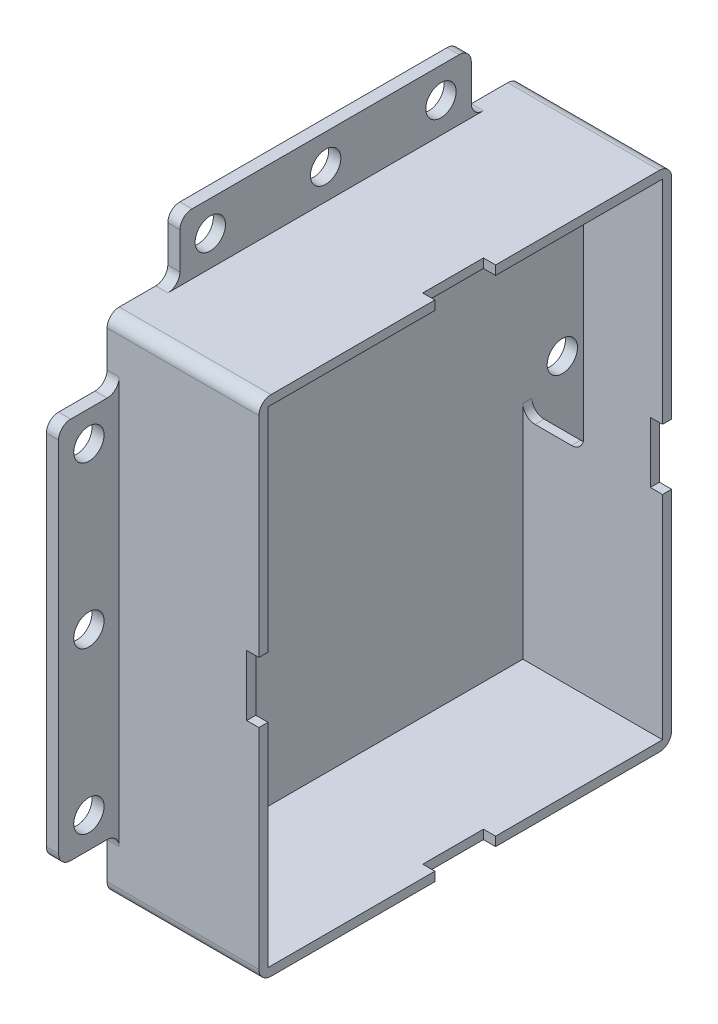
SolidWorks part; units mm, degrees
ref_plane "Plan de face" through (0, 0, 0) normal (1, 0, 0) x (0, 1, 0)
ref_plane "Plan de dessus" through (0, 0, 0) normal (0, 0, 1) x (0, 1, 0)
ref_plane "Plan de droite" through (0, 0, 0) normal (0, 1, 0) x (-1, 0, 0)
sketch "Esquisse1" plane through (0, 0, 0) normal (1, 0, 0) x (0, 1, 0)
  line L0 (-1.5, -1.5) -> (-1.5, 66.5)
  line L1 (0, 0) -> (80, 0)
  line L2 (0, 0) -> (0, 65)
  line L3 (0, 65) -> (80, 65)
  line L4 (80, 0) -> (80, 65)
  line L5 (-1.5, 66.5) -> (81.5, 66.5)
  line L6 (81.5, -1.5) -> (81.5, 66.5)
  line L7 (-1.5, -1.5) -> (81.5, -1.5)
  dimension "D1" = 65
  dimension "D2" = 80
  dimension "D3" = 1.5
extrude "Boss.-Extru.1" add sketch "Esquisse1" along normal blind 25
sketch "Esquisse2" plane through (0, 0, 0) normal (-1, 0, 0) x (0, -1, 0)
  line L1 (-81.5, 66.5) -> (1.5, 66.5)
  line L2 (-81.5, 66.5) -> (-81.5, -1.5)
  line L3 (-81.5, -1.5) -> (1.5, -1.5)
  line L4 (1.5, 66.5) -> (1.5, -1.5)
  line L5 (-71.5, -1.5) -> (-8.5, -1.5)
  line L6 (-71.5, -1.5) -> (-71.5, -11.5)
  line L7 (-71.5, -11.5) -> (-8.5, -11.5)
  line L8 (-8.5, -1.5) -> (-8.5, -11.5)
  line L9 (-81.5, 56.5) -> (-91.5, 56.5)
  line L10 (-81.5, 56.5) -> (-81.5, 8.5)
  line L11 (-81.5, 8.5) -> (-91.5, 8.5)
  line L12 (-91.5, 56.5) -> (-91.5, 8.5)
  line L13 (1.5, 56.5) -> (11.5, 56.5)
  line L14 (1.5, 56.5) -> (1.5, 8.5)
  line L15 (1.5, 8.5) -> (11.5, 8.5)
  line L16 (11.5, 56.5) -> (11.5, 8.5)
  line L17 (-71.5, 66.5) -> (-8.5, 66.5)
  line L18 (-71.5, 66.5) -> (-71.5, 76.5)
  line L19 (-71.5, 76.5) -> (-8.5, 76.5)
  line L20 (-8.5, 66.5) -> (-8.5, 76.5)
  circle A0 centre (-86.5, 51.5) radius 2.5
  circle A1 centre (-86.5, 32.5) radius 2.5
  circle A2 centre (-86.5, 13.5) radius 2.5
  circle A3 centre (-66.5, -6.5) radius 2.5
  circle A4 centre (-40, -6.5) radius 2.5
  circle A5 centre (-13.5, -6.5) radius 2.5
  circle A6 centre (6.5, 13.5) radius 2.5
  circle A7 centre (6.5, 32.5) radius 2.5
  circle A8 centre (6.5, 51.5) radius 2.5
  circle A9 centre (-66.5, 71.5) radius 2.5
  circle A10 centre (-40, 71.5) radius 2.5
  circle A11 centre (-13.5, 71.5) radius 2.5
  point P35 (-71.5, -6.5)
  point P36 (-40, -11.5)
  point P37 (-91.5, 32.5)
  point P39 (-86.5, 56.5)
  dimension "D13" = 5
  dimension "D14" = 5
  dimension "D15" = 5
  dimension "D19" = 5
  dimension "D20" = 5
  dimension "D21" = 5
  dimension "D1" = 10
  dimension "D2" = 10
  dimension "D3" = 10
  dimension "D4" = 10
  dimension "D5" = 10
  dimension "D6" = 10
  dimension "D7" = 10
  dimension "D8" = 10
  dimension "D9" = 10
  dimension "D10" = 10
  dimension "D11" = 10
  dimension "D12" = 10
  dimension "D16" = 0
  dimension "D17" = 5
  dimension "D18" = 5
  dimension "D22" = 5
  dimension "D23" = 5
  dimension "D24" = 0
  dimension "D26" = 2
  dimension "D25" = 2
extrude "Boss.-Extru.2" add sketch "Esquisse2" against normal blind 2 contours L9 L12 L11 L2 A2 A1 A0 | L1 L20 L19 L18 A11 A10 A9 | L16 L13 L4 L15 A8 A7 A6 | L8 L3 L6 L7 A5 A4 A3
sketch "Esquisse3" plane through (0, 0, -1.5) normal (0, 0, -1) x (1, 0, 0)
  line L1 (2, -71.5) -> (12, -71.5)
  line L2 (2, -71.5) -> (2, -34.5)
  line L3 (2, -34.5) -> (12, -34.5)
  line L4 (12, -71.5) -> (12, -34.5)
  dimension "D1" = 37
  dimension "D2" = 10
extrude "Enlèv. mat.-Extru.1" cut sketch "Esquisse3" against normal blind 2
sketch "Esquisse4" plane through (25, 0, 0) normal (1, 0, 0) x (0, 1, 0)
  line L0 (0, 0) -> (80, 0) construction
  line L1 (35, 0) -> (45, 0)
  line L2 (35, 0) -> (35, -1.5)
  line L3 (35, -1.5) -> (45, -1.5)
  line L4 (45, 0) -> (45, -1.5)
  line L5 (-1.5, -1.5) -> (81.5, -1.5) construction
  line L6 (-1.5, 8.5) -> (-1.5, 56.5) construction
  line L7 (-1.5, 37.5) -> (0, 37.5)
  line L8 (-1.5, 37.5) -> (-1.5, 27.5)
  line L9 (-1.5, 27.5) -> (0, 27.5)
  line L10 (0, 37.5) -> (0, 27.5)
  line L11 (0, 65) -> (0, 0) construction
  line L12 (8.5, 66.5) -> (71.5, 66.5) construction
  line L13 (35, 66.5) -> (45, 66.5)
  line L14 (35, 66.5) -> (35, 65)
  line L15 (35, 65) -> (45, 65)
  line L16 (45, 66.5) -> (45, 65)
  line L17 (0, 65) -> (80, 65) construction
  line L18 (80, 65) -> (80, 0) construction
  line L19 (80, 37.5) -> (81.5, 37.5)
  line L20 (80, 37.5) -> (80, 27.5)
  line L21 (80, 27.5) -> (81.5, 27.5)
  line L22 (81.5, 37.5) -> (81.5, 27.5)
  line L23 (81.5, 56.5) -> (81.5, 8.5) construction
  line L24 (0, 0) -> (0, 65) construction
  line L25 (80, 65) -> (0, 65) construction
  point P34 (0, 32.5)
  point P35 (0, 32.5)
  point P36 (80, 32.5)
  point P37 (80, 32.5)
  point P40 (40, 65)
  point P41 (40, 0)
  point P42 (40, 66.5)
  dimension "D1" = 10
  dimension "D2" = 10
  dimension "D3" = 10
  dimension "D4" = 10
extrude "Enlèv. mat.-Extru.2" cut sketch "Esquisse4" against normal blind 2
fillet "Congé1" radius 2 23 edges at (1, -1.5, 8.5) (1, -11.5, 56.5) (1, -1.5, 56.5) (1, 8.5, 66.5) (1, 8.5, 76.5) (12.5, -1.5, 66.5) (1, 71.5, 76.5) (1, 71.5, 66.5) (1, 81.5, 56.5) (1, 91.5, 56.5) (12.5, 81.5, 66.5) (12.5, 81.5, -1.5) (1, 91.5, 8.5) (1, 81.5, 8.5) (1, 71.5, -11.5) (12, 71.5, -0.75) (12, 34.5, -0.75) (2, 71.5, -0.75) (2, 34.5, -0.75) (1, 8.5, -1.5) (1, 8.5, -11.5) (12.5, -1.5, -1.5) (1, -11.5, 8.5)
fillet "Congé2" radius 2 1 edges at (1, 71.5, -1.5)
sketch "Esquisse5" plane through (25, 0, 0) normal (1, 0, 0) x (0, 1, 0)
  line L1 (0, 65) -> (80, 65)
  line L2 (0, 65) -> (0, 0)
  line L3 (0, 0) -> (80, 0)
  line L4 (80, 65) -> (80, 0)
  line L5 (-1.5, 37.5) -> (0, 37.5)
  line L6 (-1.5, 37.5) -> (-1.5, 27.5)
  line L7 (-1.5, 27.5) -> (0, 27.5)
  line L8 (0, 37.5) -> (0, 27.5)
  line L9 (35, -1.5) -> (45, -1.5)
  line L10 (35, -1.5) -> (35, 0)
  line L11 (35, 0) -> (45, 0)
  line L12 (45, -1.5) -> (45, 0)
  line L13 (80, 37.5) -> (81.5, 37.5)
  line L14 (80, 37.5) -> (80, 27.5)
  line L15 (80, 27.5) -> (81.5, 27.5)
  line L16 (81.5, 37.5) -> (81.5, 27.5)
  line L17 (35, 66.5) -> (45, 66.5)
  line L18 (35, 66.5) -> (35, 65)
  line L19 (35, 65) -> (45, 65)
  line L20 (45, 66.5) -> (45, 65)
  line L21 (34.5, 9) -> (71.5, 9)
  line L22 (34.5, 9) -> (34.5, 2)
  line L23 (34.5, 2) -> (71.5, 2)
  line L24 (71.5, 9) -> (71.5, 2)
  circle A0 centre (34.5, 5.5) radius 3.5
  circle A1 centre (71.5, 5.5) radius 3.5
  dimension "D1" = 7
  dimension "D2" = 2
